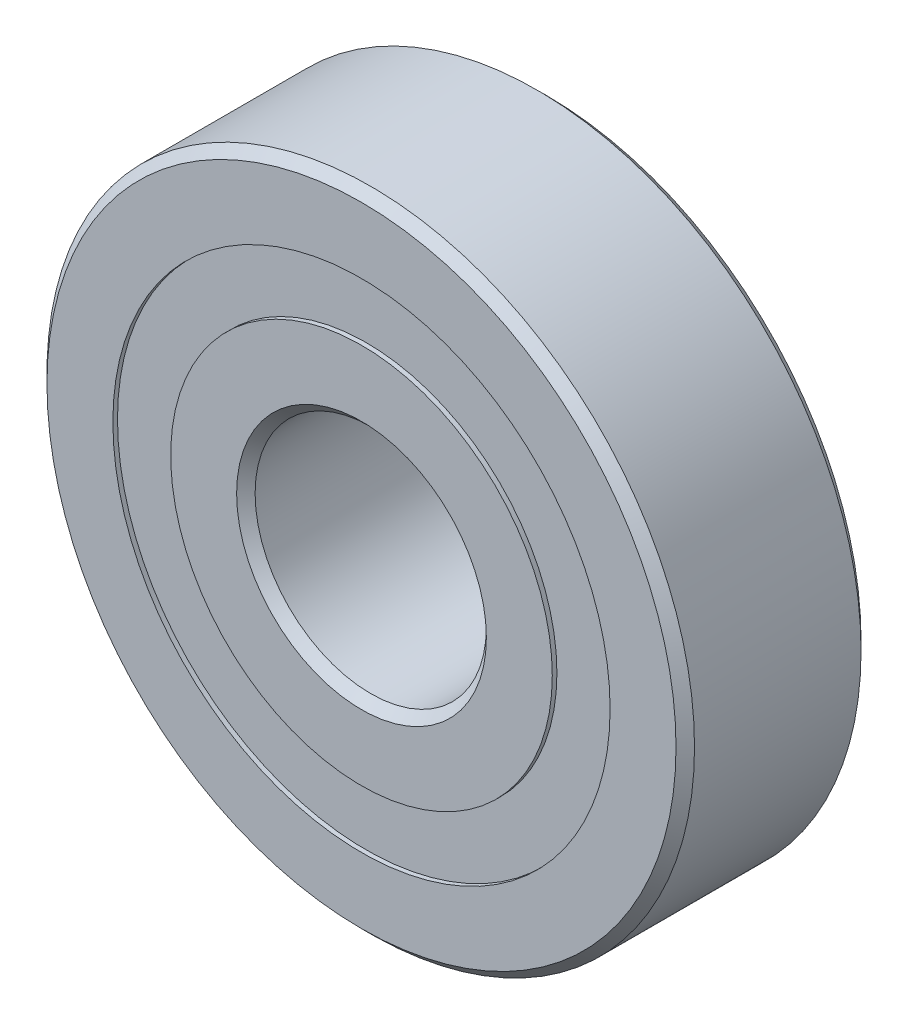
SolidWorks part; units mm, degrees
ref_plane "Front Plane" through (0, 0, 0) normal (0, 0, 1) x (1, 0, 0)
ref_plane "Top Plane" through (0, 0, 0) normal (0, 1, 0) x (1, 0, 0)
ref_plane "Right Plane" through (0, 0, 0) normal (1, 0, 0) x (0, 0, -1)
sketch "Sketch1" plane through (0, 0, 0) normal (0, 0, 1) x (1, 0, 0)
  circle A0 centre (0, 0) radius 14 construction
  circle A1 centre (0, 0) radius 5 construction
sketch "Sketch2" plane through (0, 0, 0) normal (1, 0, 0) x (0, 0, -1)
  line L0 (-4, 0) -> (4, 0) construction
  line L1 (0, 14) -> (0, -14) construction
  line L2 (3.6, 14) -> (-3.6, 14) construction
  line L3 (-3.6, 14) -> (-4, 13.6) construction
  line L4 (-4, 13.6) -> (-4, 10.75) construction
  line L5 (-4, 10.75) -> (-1.7778, 10.75) construction
  line L6 (4, 10.75) -> (1.7778, 10.75) construction
  line L7 (4, 13.6) -> (4, 10.75) construction
  line L8 (3.6, 14) -> (4, 13.6) construction
  line L9 (0, 14) -> (0, 9.5) construction
  line L10 (0, 9.5) -> (0, 5) construction
  line L11 (4, 9.5) -> (-4, 9.5) construction
  line L12 (-4, 5.4) -> (-4, 8.25) construction
  line L13 (-3.6, 5) -> (-4, 5.4) construction
  line L14 (3.6, 5) -> (-3.6, 5) construction
  line L15 (3.6, 5) -> (4, 5.4) construction
  line L16 (4, 5.4) -> (4, 8.25) construction
  line L17 (4, 8.25) -> (1.7778, 8.25) construction
  line L18 (-4, 8.25) -> (-1.7778, 8.25) construction
  line L19 (-4, 6) -> (-4, -6) construction
  line L20 (4, 14) -> (4, -14) construction
  arc A0 (-1.7778, 10.75) -> (1.7778, 10.75) centre (0, 9.5) cw construction
  arc A1 (-1.7778, 8.25) -> (1.7778, 8.25) centre (0, 9.5) ccw construction
  point P14 (0, 5)
  point P18 (0, 9.5)
sketch "Sketch3" plane through (0, 0, 0) normal (1, 0, 0) x (0, 0, -1)
  line L0 (-4, 13.6) -> (-4, 10.75) construction
  line L1 (-3.6, 14) -> (-4, 13.6) construction
  line L2 (3.6, 14) -> (-3.6, 14) construction
  line L3 (3.6, 14) -> (4, 13.6) construction
  line L4 (4, 13.6) -> (4, 10.75) construction
  line L5 (4, 10.75) -> (1.7778, 10.75) construction
  line L6 (-4, 10.75) -> (-1.7778, 10.75) construction
  line L7 (-4, 13.6) -> (-4, 10.75)
  line L8 (-3.6, 14) -> (-4, 13.6)
  line L9 (3.6, 14) -> (-3.6, 14)
  line L10 (3.6, 14) -> (4, 13.6)
  line L11 (4, 13.6) -> (4, 10.75)
  line L12 (4, 10.75) -> (1.7778, 10.75)
  line L13 (-4, 10.75) -> (-1.7778, 10.75)
  line L14 (-4, 5.4) -> (-4, 8.25) construction
  line L15 (-3.6, 5) -> (-4, 5.4) construction
  line L16 (3.6, 5) -> (-3.6, 5) construction
  line L17 (3.6, 5) -> (4, 5.4) construction
  line L18 (4, 5.4) -> (4, 8.25) construction
  line L19 (4, 8.25) -> (1.7778, 8.25) construction
  line L20 (-4, 8.25) -> (-1.7778, 8.25) construction
  line L21 (-4, 5.4) -> (-4, 8.25)
  line L22 (-3.6, 5) -> (-4, 5.4)
  line L23 (3.6, 5) -> (-3.6, 5)
  line L24 (3.6, 5) -> (4, 5.4)
  line L25 (4, 5.4) -> (4, 8.25)
  line L26 (4, 8.25) -> (1.7778, 8.25)
  line L27 (-4, 8.25) -> (-1.7778, 8.25)
  arc A0 (1.7778, 10.75) -> (-1.7778, 10.75) centre (0, 9.5) ccw construction
  arc A1 (1.7778, 10.75) -> (-1.7778, 10.75) centre (0, 9.5) ccw
  arc A2 (-1.7778, 8.25) -> (1.7778, 8.25) centre (0, 9.5) ccw construction
  arc A3 (-1.7778, 8.25) -> (1.7778, 8.25) centre (0, 9.5) ccw
revolve "Revolve1" add sketch "Sketch3" angle 360 about L0
sketch "Sketch4" plane through (0, 0, 0) normal (1, 0, 0) x (0, 0, -1)
  line L0 (-2.1732, 9.5) -> (2.1732, 9.5)
  arc A2 (-2.1732, 9.5) -> (2.1732, 9.5) centre (0, 9.5) cw
  arc A3 (1.7778, 10.75) -> (-1.7778, 10.75) centre (0, 9.5) ccw construction
revolve "Revolve2" add sketch "Sketch4" angle 360 about L0
pattern_circular "CirPattern1" count 10 over 360 about axis through (0, 0, 0) along (0, 0, 1)
sketch "Sketch5" plane through (0, 0, 0) normal (1, 0, 0) x (0, 0, -1)
  line L0 (-4, 10.75) -> (-1.7778, 10.75) construction
  line L1 (-3.8, 10.75) -> (-2.1732, 10.75)
  line L2 (-3.8, 10.75) -> (-3.8, 8.25)
  line L3 (-3.8, 8.25) -> (-2.1732, 8.25)
  line L4 (-2.1732, 10.75) -> (-2.1732, 8.25)
  line L6 (4, 10.75) -> (1.7778, 10.75) construction
  line L7 (3.8, 10.75) -> (2.1732, 10.75)
  line L8 (3.8, 10.75) -> (3.8, 8.25)
  line L9 (3.8, 8.25) -> (2.1732, 8.25)
  line L10 (2.1732, 10.75) -> (2.1732, 8.25)
  line L12 (-3.6, 14) -> (-4, 13.6) construction
  line L13 (-4, 8.25) -> (-1.7778, 8.25) construction
  line L14 (4, 8.25) -> (1.7778, 8.25) construction
  point P18 (-3.8, 13.8)
revolve "Revolve3" add sketch "Sketch5" angle 360 about L0
equation "\"D2@Sketch2\"= \"Width@Sketch2\" * .05"
equation "\"D3@Sketch2\"=\"Width@Sketch2\" / 2.25"
equation "\"D4@Sketch2\"=( \"OD@Sketch1\" - \"Width@Sketch2\" ) *.5 *.125"
equation "\"Approx. No. of Balls\"= ( pi * \"OD@Sketch1\" ) * .5 / \"Approx. Ball Dia.@Sketch2\""
equation "\"Balls@CirPattern1\"=\"Approx. No. of Balls\""
